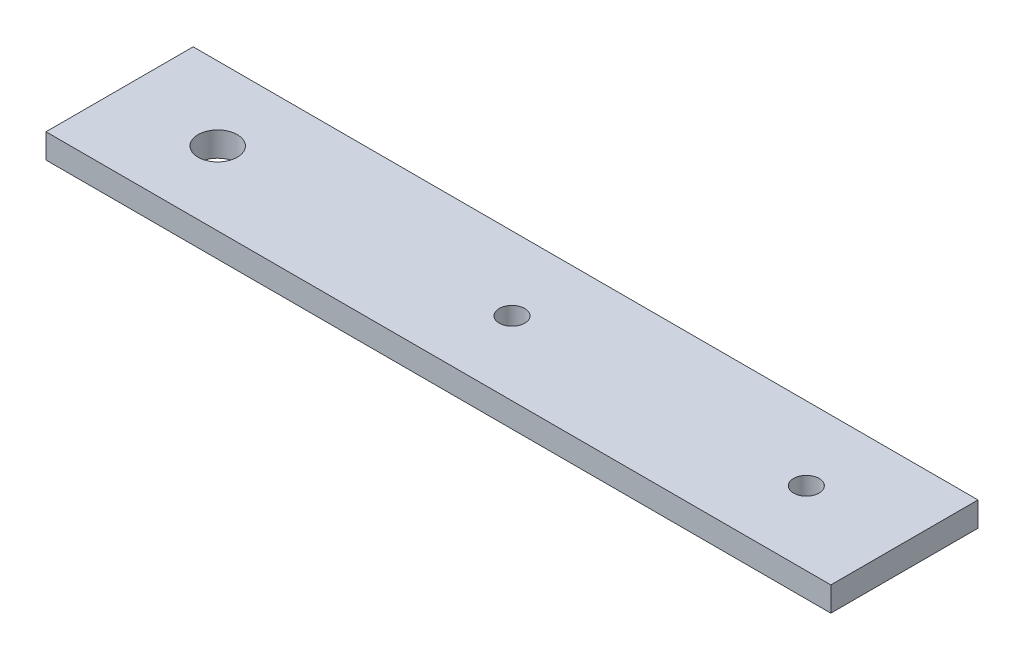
SolidWorks part; units mm, degrees
ref_plane "Front" through (0, 0, 0) normal (0, 0, 1) x (1, 0, 0)
ref_plane "Top" through (0, 0, 0) normal (0, 1, 0) x (1, 0, 0)
ref_plane "Right" through (0, 0, 0) normal (1, 0, 0) x (0, 0, -1)
other "Configuration Table"
sketch "Sketch1" plane through (0, 0, 0) normal (0, 1, 0) x (1, 0, 0)
  line L0 (0, 0) -> (101.6, 0)
  line L1 (0, 0) -> (0, 19.05)
  line L2 (101.6, 19.05) -> (0, 19.05)
  line L3 (101.6, 19.05) -> (101.6, 0)
  circle A0 centre (12.7, 9.525) radius 2.54
  circle A1 centre (50.8, 9.525) radius 1.651
  circle A2 centre (88.9, 9.525) radius 1.651
  point P11 (101.6, 9.525)
  dimension "D3" = 3.302
  dimension "D7" = 5.08
  dimension "D1" = 101.6
  dimension "D2" = 19.05
  dimension "D4" = 38.1
  dimension "D5" = 12.7
  dimension "D6" = 12.7
extrude "Base-Extrude" add sketch "Sketch1" along normal blind 3.175
